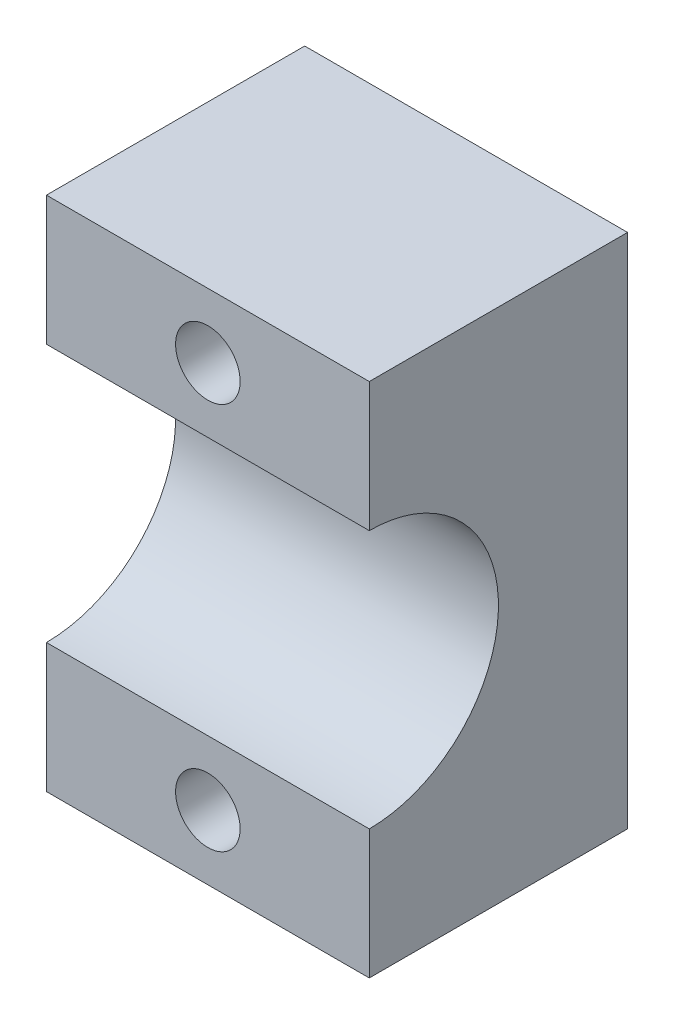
SolidWorks part; units mm, degrees
ref_plane "Plan de face" through (0, 0, 0) normal (0, 0, 1) x (1, 0, 0)
ref_plane "Plan de dessus" through (0, 0, 0) normal (0, 1, 0) x (1, 0, 0)
ref_plane "Plan de droite" through (0, 0, 0) normal (1, 0, 0) x (0, 0, -1)
sketch "Esquisse1" plane through (0, 0, 0) normal (0, 0, 1) x (1, 0, 0)
  line L1 (-23.4, 8) -> (-13.4, 8)
  line L2 (-23.4, 8) -> (-23.4, -8)
  line L3 (-23.4, -8) -> (-13.4, -8)
  line L4 (-13.4, 8) -> (-13.4, -8)
  line L9 (-23.4, 0) -> (23.4, 0) construction
  dimension "D1" = 10
  dimension "D2" = 16
extrude "Boss.-Extru.1" add sketch "Esquisse1" along normal blind 8
sketch "Esquisse2" plane through (-13.4, 0, 0) normal (1, 0, 0) x (0, 0, -1)
  line L0 (-8, -8) -> (-8, 8) construction
  line L1 (0, 0) -> (-16.4108, 0) construction
  circle A0 centre (-8, 0) radius 4
  dimension "D1" = 8
extrude "Enlèv. mat.-Extru.1" cut sketch "Esquisse2" against normal blind 13
sketch "Esquisse3" plane through (0, 0, 8) normal (0, 0, 1) x (1, 0, 0)
  line L0 (-18.4, 8) -> (-18.4, -8.4619) construction
  line L1 (-13.4, 8) -> (-23.4, 8) construction
  line L2 (-24.7524, 6) -> (-11.1733, 6) construction
  line L3 (-24.7524, -6) -> (-12.2549, -6) construction
  line L5 (-23.4, -8) -> (-13.4, -8) construction
  circle A0 centre (-18.4, 6) radius 1
  circle A1 centre (-18.4, -6) radius 1
  dimension "D1" = 2
  dimension "D2" = 2
  dimension "D3" = 2
  dimension "D4" = 2
extrude "Enlèv. mat.-Extru.2" cut sketch "Esquisse3" against normal blind 13
